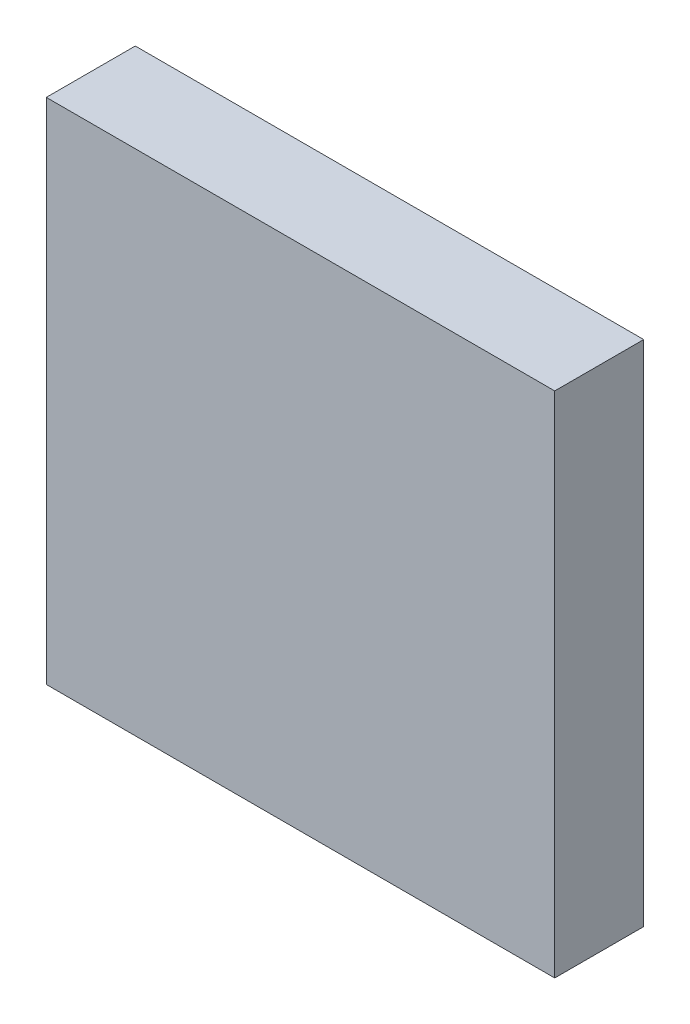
SolidWorks part; units mm, degrees
ref_plane "Plan1" through (0, 0, 0) normal (0, 0, 1) x (1, 0, 0)
ref_plane "Plan2" through (0, 0, 0) normal (0, 1, 0) x (1, 0, 0)
ref_plane "Plan3" through (0, 0, 0) normal (1, 0, 0) x (0, 0, -1)
sketch "Esquisse1" plane through (0, 0, 0) normal (0, 0, 1) x (1, 0, 0)
  line L1 (-40, 60) -> (-20, 60)
  line L2 (-40, 60) -> (-40, 40)
  line L3 (-40, 40) -> (-20, 40)
  line L4 (-20, 60) -> (-20, 40)
extrude "Base-Extrusion" add sketch "Esquisse1" along normal blind 3.5
